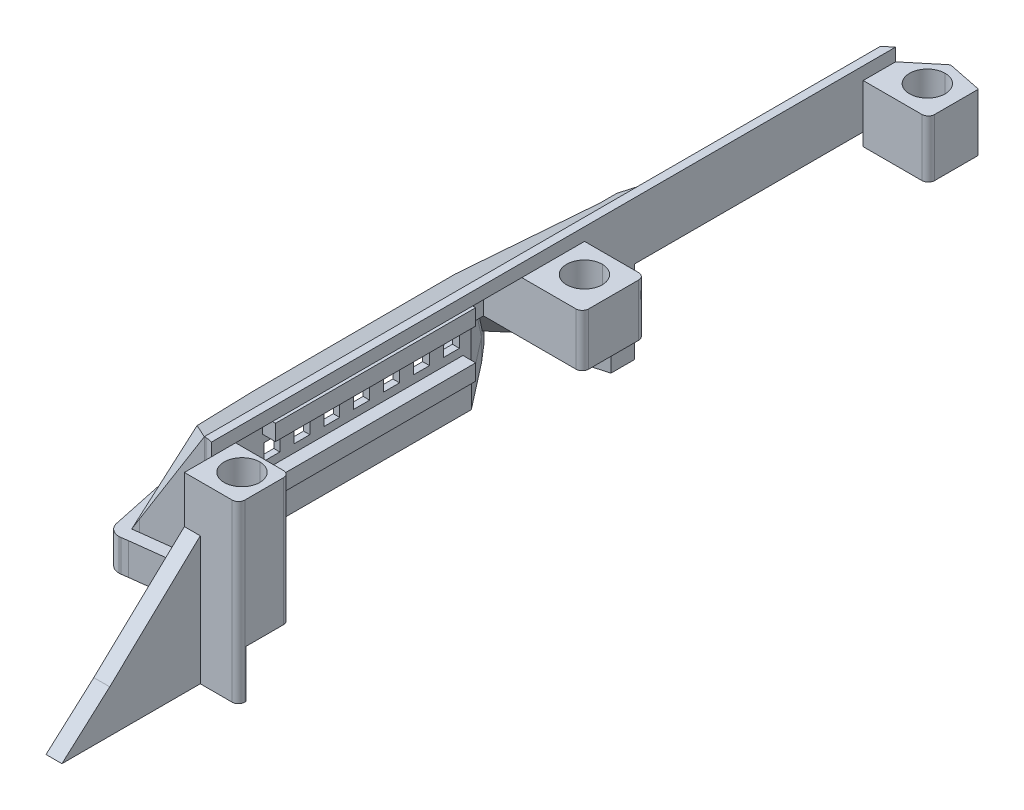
SolidWorks part; units mm, degrees
other "<侧板2（包围式）加灯光>-<侧板2（包围式）加灯光.STEP<1>>"
ref_plane "前视基准面" through (0, 0, 0) normal (0, 0, 1) x (1, 0, 0)
ref_plane "上视基准面" through (0, 0, 0) normal (0, 1, 0) x (1, 0, 0)
ref_plane "右视基准面" through (0, 0, 0) normal (1, 0, 0) x (0, 0, -1)
mirrored part "侧板2（包围式）加灯光_镜向"
